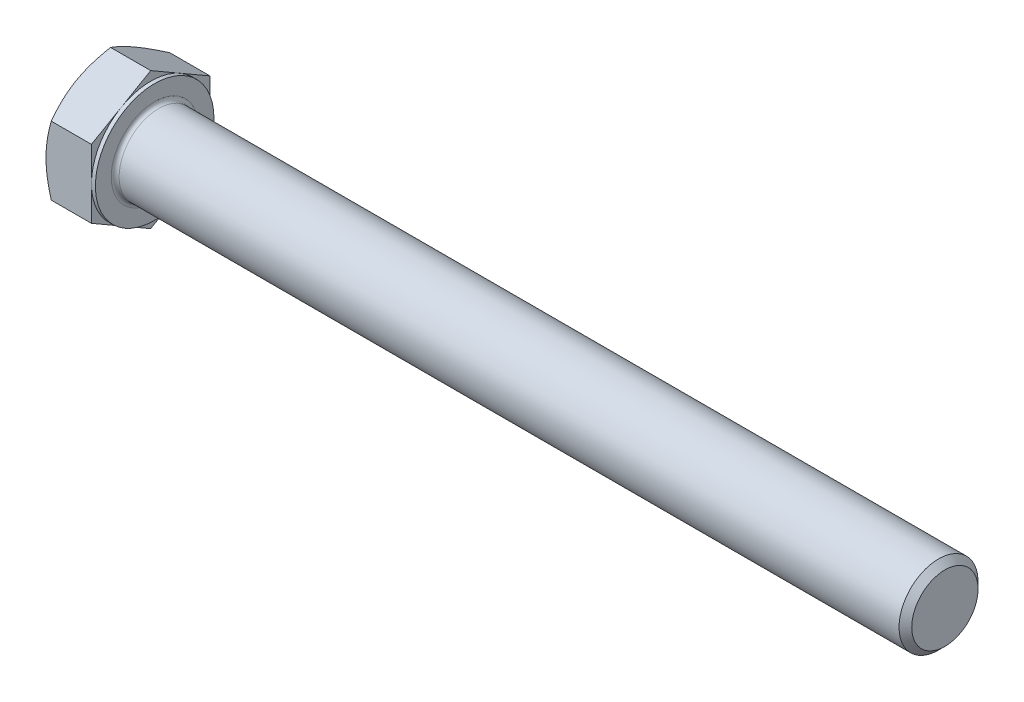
SolidWorks part; units mm, degrees
extrude "BaseHead" add sketch "Sketch1" along normal blind 7.5
sketch "Sketch1" plane through (0, 0, 0) normal (1, 0, 0) x (0, 0, -1)
  line L0 (9, 5.1962) -> (9, -5.1962)
  line L1 (-9, 5.1962) -> (-9, -5.1962)
  line L2 (9, -5.1962) -> (0, -10.3923)
  line L3 (0, -10.3923) -> (-9, -5.1962)
  line L4 (9, 5.1962) -> (0, 10.3923)
  line L5 (0, 10.3923) -> (-9, 5.1962)
revolve "HeadChamfer" cut sketch "Sketch3" angle 360 about L6
sketch "Sketch3" plane through (0, 0, 0) normal (0, 0, 1) x (1, 0, 0)
  line L0 (0, 9) -> (3.6906, 15.3923)
  line L1 (0, 10.3923) -> (0, 5.1962) construction
  line L2 (3.6906, 15.3923) -> (3.6906, 20.3923)
  line L3 (3.6906, 20.3923) -> (-10, 20.3923)
  line L4 (-10, 20.3923) -> (-10, 9)
  line L5 (-10, 9) -> (0, 9)
  line L6 (0, 0) -> (99.06, 0) construction
  line L7 (7.5, 10.3923) -> (0, 10.3923) construction
ref_plane "Plane1" through (0, 0, 0) normal (0, 0, 1) x (1, 0, 0)
ref_plane "Plane2" through (0, 0, 0) normal (0, 1, 0) x (1, 0, 0)
ref_plane "Plane3" through (0, 0, 0) normal (1, 0, 0) x (0, 0, -1)
sketch "BodySke" plane through (0, 0, 0) normal (0, 0, 1) x (1, 0, 0)
  line L0 (0, 5.1962) -> (0, -5.1962) construction
  line L1 (0, 0) -> (127.5, 0)
  line L2 (0, 0) -> (0, 6)
  line L3 (0, 6) -> (126.536, 6)
  line L4 (127.5, 0) -> (127.5, 5.036)
  line L5 (7.5, 10.3923) -> (7.5, 5.1962) construction
  line L6 (127.5, 5.036) -> (126.536, 6)
  line L7 (0, 0) -> (96.52, 0) construction
  line L8 (127.5, -5.036) -> (126.536, -6) construction
  line L9 (0, -6) -> (126.536, -6) construction
  line L10 (9.25, 15.24) -> (9.25, -1.27) construction
  line L11 (97.5, 15.24) -> (97.5, -1.27) construction
  line L12 (7.5, 5.1962) -> (7.5, -5.1962) construction
revolve "BaseBody" add sketch "BodySke"
fillet "HeadFillet" radius 0.6 1 edges at (7.5, 0, -6)
sketch "Sketch4" plane through (0, 0, 0) normal (0, 0, 1) x (1, 0, 0)
  line L1 (7.5, 10.3923) -> (7.5, 5.1962) construction
  line L2 (7.5, 9) -> (6.9, 9)
  line L3 (7.5, 9) -> (7.5, 20.3923)
  line L4 (7.5, 20.3923) -> (6.9, 20.3923)
  line L5 (0, 0) -> (95.25, 0) construction
  line L6 (0, 0) -> (96.52, 0) construction
  line L7 (6.9, 9) -> (6.9, 20.3923)
  line L8 (7.5, 10.3923) -> (0.8038, 10.3923) construction
revolve "BearingFace" cut sketch "Sketch4" angle 360 about L5
sketch "ThdSchSke" plane through (0, 0, 0) normal (0, 0, 1) x (1, 0, 0)
  line L0 (97.5, -5.036) -> (96.825, -6)
  line L1 (97.5, -5.036) -> (98.175, -6)
  line L2 (98.175, -6) -> (98.175, -7.5)
  line L3 (-3.175, 0) -> (5.1513, 0) construction
  line L5 (98.175, -7.5) -> (96.825, -7.5)
  line L6 (96.825, -7.5) -> (96.825, -6)
revolve "ThreadSchematic" [suppressed] cut sketch "ThdSchSke" angle 360 about L3
pattern_linear "ThdSchPat" [suppressed]
equation "\"D3@Sketch1\" = \"Width_flats@Sketch1\" / 2"
equation "\"D4@Sketch1\" = \"D3@Sketch1\""
equation "\"D5@Sketch1\" = \"D4@Sketch1\""
equation "\"Thread_minor@ThreadCosmetic\" = \"Minor_dia@BodySke\""
equation "\"D1@Sketch3\" = \"Width_flats@Sketch1\" / 2"
equation "\"D1@Sketch4\" = \"Width_flats@Sketch1\""
equation "\"Thread_length@ThreadCosmetic\" = ((sgn( (\"Length@BodySke\" - \"Advance@BodySke\" ) - \"Thread_nom@BodySke\" )-1)*( (\"Length@BodySke\" - \"Advance@BodySke\" ) - \"Thread_nom@BodySke\" ))/-2+ \"Thread_nom@BodySke\""
equation "\"Thread_minor@ThdSchSke\" = \"Minor_dia@BodySke\""
equation "\"Diameter@ThdSchSke\" = \"Diameter@BodySke\""
equation "\"Overcut@ThdSchSke\" = \"Diameter@BodySke\" * 1.25"
equation "\"Start@ThdSchSke\" = \"Head_ht@BaseHead\" + \"Length@BodySke\" - \"Thread_length@ThreadCosmetic\"  '---Non-countersunk---"
equation "\"Num_threads@ThdSchPat\" = int( \"Thread_length@ThreadCosmetic\" / \"Advance@BodySke\" + 0.999 )  + 1"
equation "\"Advance@ThdSchPat\" = \"Thread_length@ThreadCosmetic\" /  (\"Num_threads@ThdSchPat\" - 1) 'relax it"
equation "\"Num_threads@ThdSchPat\" = \"Num_threads@ThdSchPat\" - sgn( \"Num_threads@ThdSchPat\" - 1) '---chamfered tips only---"
